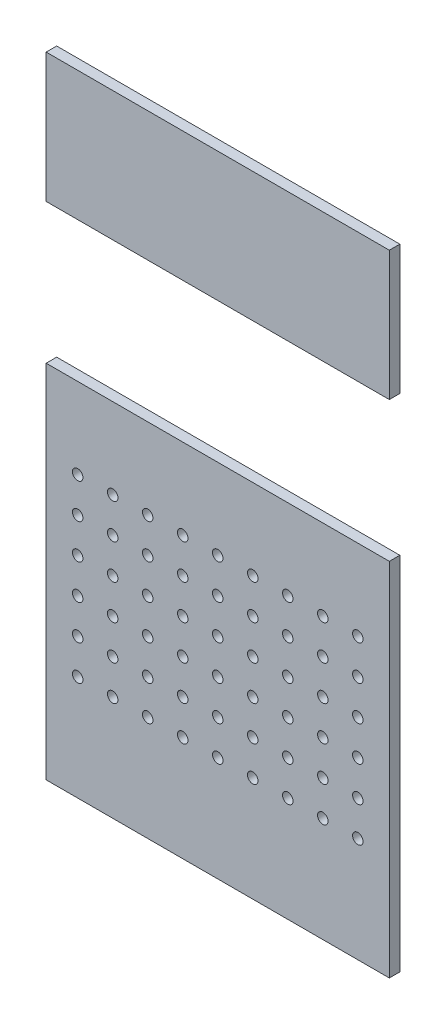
SolidWorks part; units mm, degrees
ref_plane "Alzado" through (0, 0, 0) normal (0, 0, 1) x (1, 0, 0)
ref_plane "Planta" through (0, 0, 0) normal (0, 1, 0) x (1, 0, 0)
ref_plane "Vista lateral" through (0, 0, 0) normal (1, 0, 0) x (0, 0, -1)
sketch "Croquis1" plane through (0, 0, 0) normal (0, 0, 1) x (1, 0, 0)
  line L0 (74.5513, 28.5876) -> (74.5513, -74.4668)
  line L1 (-23.4487, 105.5332) -> (74.5513, 105.5332)
  line L2 (-23.4487, 105.5332) -> (-23.4487, 68.5876)
  line L3 (-23.4487, -74.4668) -> (74.5513, -74.4668)
  line L4 (74.5513, 105.5332) -> (74.5513, 68.5876)
  line L5 (-23.4487, 68.5876) -> (74.5513, 68.5876)
  line L6 (-23.4487, 28.5876) -> (-23.4487, -74.4668)
  line L7 (-23.4487, 28.5876) -> (74.5513, 28.5876)
  circle A0 centre (-14.4487, -24.4668) radius 1.5
  circle A1 centre (-4.4487, -24.4668) radius 1.5
  circle A2 centre (5.5513, -24.4668) radius 1.5
  circle A3 centre (15.5513, -24.4668) radius 1.5
  circle A4 centre (25.5513, -24.4668) radius 1.5
  circle A5 centre (35.5513, -24.4668) radius 1.5
  circle A6 centre (45.5513, -24.4668) radius 1.5
  circle A7 centre (55.5513, -24.4668) radius 1.5
  circle A8 centre (65.5513, -24.4668) radius 1.5
  circle A9 centre (-4.4487, -34.4668) radius 1.5
  circle A10 centre (5.5513, -34.4668) radius 1.5
  circle A11 centre (15.5513, -34.4668) radius 1.5
  circle A12 centre (25.5513, -34.4668) radius 1.5
  circle A13 centre (35.5513, -34.4668) radius 1.5
  circle A14 centre (45.5513, -34.4668) radius 1.5
  circle A15 centre (55.5513, -34.4668) radius 1.5
  circle A16 centre (65.5513, -34.4668) radius 1.5
  circle A17 centre (-4.4487, -44.4668) radius 1.5
  circle A18 centre (5.5513, -44.4668) radius 1.5
  circle A19 centre (15.5513, -44.4668) radius 1.5
  circle A20 centre (25.5513, -44.4668) radius 1.5
  circle A21 centre (35.5513, -44.4668) radius 1.5
  circle A22 centre (45.5513, -44.4668) radius 1.5
  circle A23 centre (55.5513, -44.4668) radius 1.5
  circle A24 centre (65.5513, -44.4668) radius 1.5
  circle A25 centre (-14.4487, -14.4668) radius 1.5
  circle A26 centre (-4.4487, -14.4668) radius 1.5
  circle A27 centre (5.5513, -14.4668) radius 1.5
  circle A28 centre (15.5513, -14.4668) radius 1.5
  circle A29 centre (25.5513, -14.4668) radius 1.5
  circle A30 centre (35.5513, -14.4668) radius 1.5
  circle A31 centre (45.5513, -14.4668) radius 1.5
  circle A32 centre (55.5513, -14.4668) radius 1.5
  circle A33 centre (65.5513, -14.4668) radius 1.5
  circle A34 centre (-4.4487, -4.4668) radius 1.5
  circle A35 centre (5.5513, -4.4668) radius 1.5
  circle A36 centre (15.5513, -4.4668) radius 1.5
  circle A37 centre (25.5513, -4.4668) radius 1.5
  circle A38 centre (35.5513, -4.4668) radius 1.5
  circle A39 centre (45.5513, -4.4668) radius 1.5
  circle A40 centre (55.5513, -4.4668) radius 1.5
  circle A41 centre (-14.4487, -34.4668) radius 1.5
  circle A42 centre (-14.4487, -44.4668) radius 1.5
  circle A43 centre (65.5513, -4.4668) radius 1.5
  circle A44 centre (-4.4487, 5.5332) radius 1.5
  circle A45 centre (-4.4487, -54.4668) radius 1.5
  circle A46 centre (5.5513, -54.4668) radius 1.5
  circle A47 centre (15.5513, -54.4668) radius 1.5
  circle A48 centre (25.5513, -54.4668) radius 1.5
  circle A49 centre (35.5513, -54.4668) radius 1.5
  circle A50 centre (45.5513, -54.4668) radius 1.5
  circle A51 centre (55.5513, -54.4668) radius 1.5
  circle A52 centre (65.5513, -54.4668) radius 1.5
  circle A53 centre (-4.4487, -64.4668) radius 1.5
  circle A54 centre (5.5513, -64.4668) radius 1.5
  circle A55 centre (15.5513, -64.4668) radius 1.5
  circle A56 centre (25.5513, -64.4668) radius 1.5
  circle A57 centre (35.5513, -64.4668) radius 1.5
  circle A58 centre (45.5513, -64.4668) radius 1.5
  circle A59 centre (55.5513, -64.4668) radius 1.5
  circle A60 centre (65.5513, -64.4668) radius 1.5
  circle A61 centre (-14.4487, -54.4668) radius 1.5
  circle A62 centre (-14.4487, -64.4668) radius 1.5
  circle A63 centre (5.5513, 5.5332) radius 1.5
  circle A64 centre (15.5513, 5.5332) radius 1.5
  circle A65 centre (25.5513, 5.5332) radius 1.5
  circle A66 centre (35.5513, 5.5332) radius 1.5
  circle A67 centre (45.5513, 5.5332) radius 1.5
  circle A68 centre (55.5513, 5.5332) radius 1.5
  circle A69 centre (65.5513, 5.5332) radius 1.5
  circle A70 centre (-14.4487, -4.4668) radius 1.5
  circle A71 centre (-14.4487, 5.5332) radius 1.5
  dimension "D3" = 2
  dimension "D1" = 98
  dimension "D2" = 180
  dimension "D5" = 50
  dimension "D8" = 40
  dimension "D6" = 9
  dimension "D7" = 5
extrude "Saliente-Extruir2" add sketch "Croquis1" along normal blind 3 contours L2 L5 L4 L1 | L7 L6 L3 L0 A71 A70 A69 A68 A67 A66 A65 A64 A63 A44 A43 A42 A41 A40 A39 A38 A37 A36 A35 A34 A33 A32 A31
